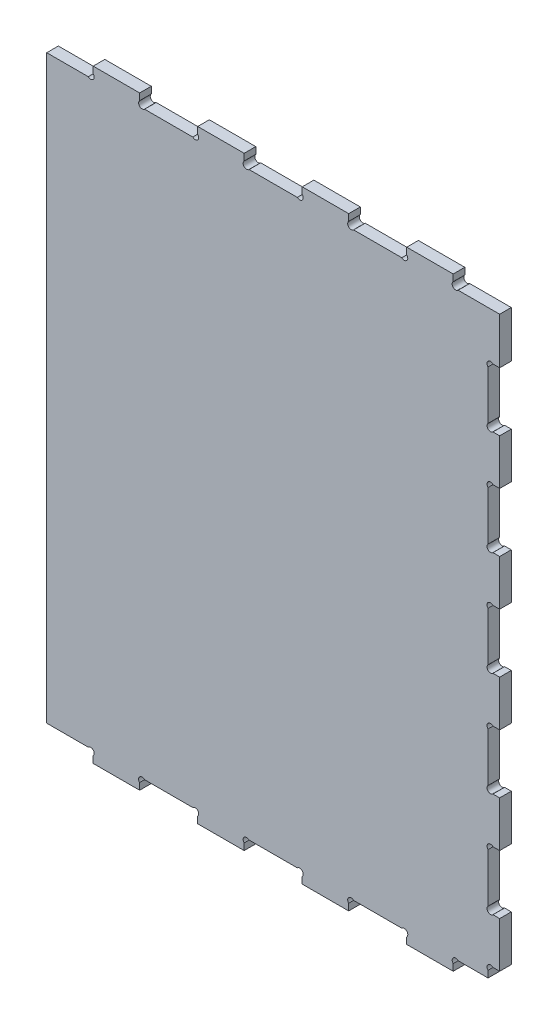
SolidWorks part; units mm, degrees
ref_plane "Alzado" through (0, 0, 0) normal (0, 0, 1) x (1, 0, 0)
ref_plane "Planta" through (0, 0, 0) normal (0, 1, 0) x (1, 0, 0)
ref_plane "Vista lateral" through (0, 0, 0) normal (1, 0, 0) x (0, 0, -1)
sketch "Croquis1" plane through (0, 0, 0) normal (0, 0, 1) x (1, 0, 0)
  line L0 (0, 0) -> (0, 500)
  line L1 (0, 0) -> (-390, 0)
  line L2 (0, 500) -> (-390, 500)
  line L3 (-390, 0) -> (-390, 500)
extrude "Saliente-Extruir1" add sketch "Croquis1" against normal blind 10
sketch "Croquis2" plane through (0, 500, 0) normal (0, 1, 0) x (1, 0, 0)
  line L0 (-80, 0) -> (-80, 5.7574) construction
  line L1 (-80, 0) -> (-40, 0)
  line L2 (-80, 0) -> (-80, 10)
  line L3 (-80, 10) -> (-40, 10)
  line L4 (-40, 0) -> (-40, 10)
  line L5 (0, 10) -> (-390, 10) construction
  line L6 (0, 0) -> (-390, 0) construction
  dimension "D1" = 40
extrude "Saliente-Extruir2" add sketch "Croquis2" along normal blind 10
sketch "Croquis3" plane through (0, 0, 0) normal (0, 0, 1) x (1, 0, 0)
  line L0 (-37.8787, 502.1213) -> (-37.8787, 500) construction
  line L1 (0, 500) -> (-40, 500) construction
  line L2 (-37.8787, 502.1213) -> (-40, 502.1213) construction
  line L3 (-40, 510) -> (-40, 500) construction
  line L4 (-60, 515.159) -> (-60, 490.9794) construction
  line L5 (-82.1213, 502.1213) -> (-80, 502.1213) construction
  line L6 (-82.1213, 502.1213) -> (-82.1213, 500) construction
  line L7 (-80, 510) -> (-40, 510) construction
  circle A0 centre (-37.8787, 502.1213) radius 3
  circle A1 centre (-82.1213, 502.1213) radius 3
  point P15 (-60, 503.0692)
  point P16 (-76.1207, 502.1213)
  point P19 (-60, 510)
  dimension "D1" = 6
extrude "Cortar-Extruir1" cut sketch "Croquis3" against normal through all both and the other way through all
pattern_linear "MatrizL1" count 4 spacing 90 along (-1, 0, 0) of "Cortar-Extruir1", "Saliente-Extruir2"
ref_plane "Plano1" through (0, 250, 0) normal (0, 1, 0) x (1, 0, 0)
mirror "Simetría1" about plane through (0, 250, 0) normal (0, 1, 0) of "MatrizL1", "Saliente-Extruir2", "Cortar-Extruir1"
sketch "Croquis4" plane through (0, 0, 0) normal (0, 0, 1) x (1, 0, 0)
  line L0 (-10, 10) -> (-10, 0) construction
  line L1 (-10, 460) -> (0, 460)
  line L2 (-10, 460) -> (-10, 409.3223)
  line L3 (-10, 409.3223) -> (0, 409.3223)
  line L4 (0, 460) -> (0, 409.3223)
  line L5 (0, 0) -> (0, 500) construction
  line L6 (0, 500) -> (-35.7574, 500) construction
  point P10 (-5, 460)
  dimension "D1" = 40
extrude "Cortar-Extruir2" cut sketch "Croquis4" against normal through all
sketch "Croquis5" plane through (0, 0, -10) normal (0, 0, -1) x (-1, 0, 0)
  line L0 (7.8787, 457.8787) -> (7.8787, 460) construction
  line L1 (0, 460) -> (10, 460) construction
  line L2 (7.8787, 457.8787) -> (10, 457.8787) construction
  line L3 (10, 460) -> (10, 409.3223) construction
  line L4 (10, 434.6612) -> (-11.7899, 434.6612) construction
  line L5 (7.8787, 411.4436) -> (10, 411.4436) construction
  line L6 (7.8787, 411.4436) -> (7.8787, 409.3223) construction
  circle A0 centre (7.8787, 457.8787) radius 3
  circle A1 centre (7.8787, 411.4436) radius 3
  point P11 (10, 434.6612)
  dimension "D1" = 6
extrude "Cortar-Extruir3" cut sketch "Croquis5" against normal through all both and the other way through all
pattern_linear "MatrizL2" count 5 spacing 90 along (0, -1, 0) of "Cortar-Extruir3", "Cortar-Extruir2"
sketch "Croquis6" plane through (0, 0, -10) normal (0, 0, -1) x (-1, 0, 0)
  line L1 (0, 0) -> (10, 0)
  line L2 (0, 0) -> (0, 10.0023)
  line L3 (0, 10.0023) -> (5.7574, 10.0023)
  line L4 (10, 0) -> (10, 5.7597)
  line L5 (5.7574, 49.3223) -> (0, 49.3223) construction
  line L6 (7.8787, 7.881) -> (7.8787, 10.0023) construction
  line L7 (7.8787, 7.881) -> (10, 7.881) construction
  arc A0 (10, 5.7597) -> (5.7574, 10.0023) centre (7.8787, 7.881) ccw
  point P1 (0, 0)
  dimension "D3" = 6
  dimension "D2" = 39.32
extrude "Cortar-Extruir4" cut sketch "Croquis6" against normal through all both and the other way through all
